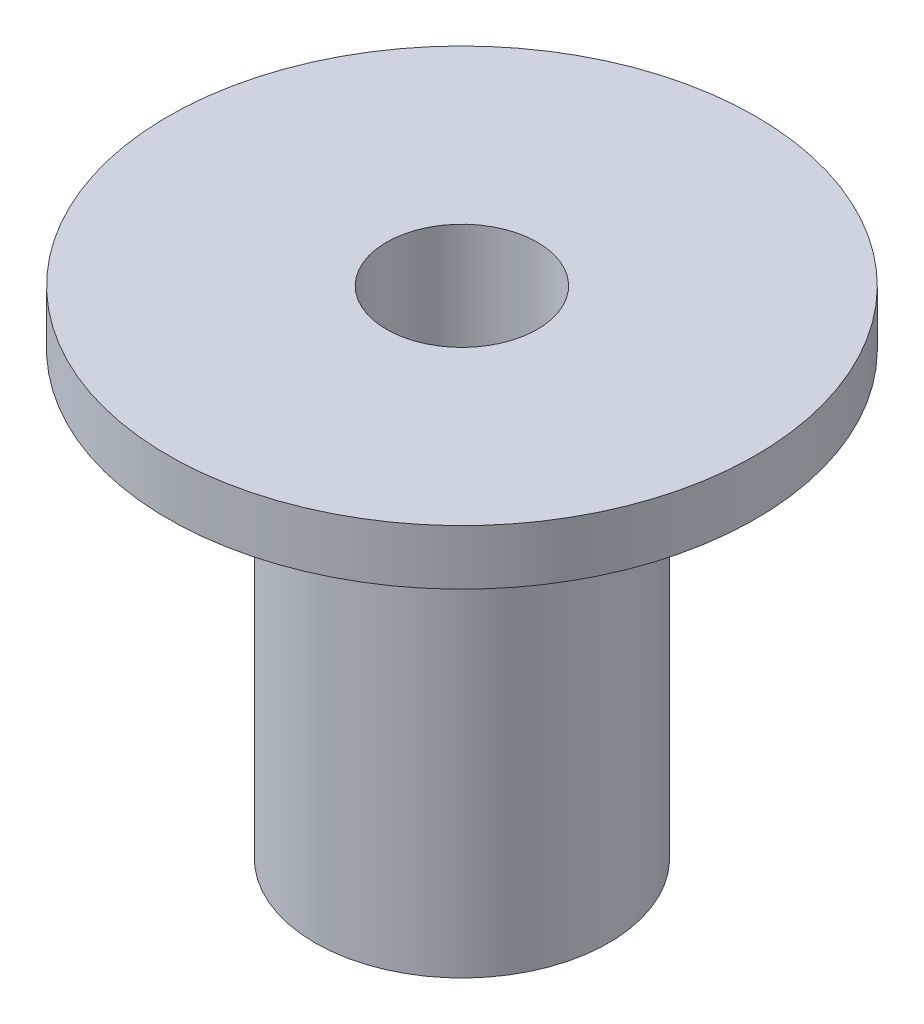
SolidWorks part; units mm, degrees
ref_plane "Front Plane" through (0, 0, 0) normal (0, 0, 1) x (1, 0, 0)
ref_plane "Top Plane" through (0, 0, 0) normal (0, 1, 0) x (1, 0, 0)
ref_plane "Right Plane" through (0, 0, 0) normal (1, 0, 0) x (0, 0, -1)
sketch "Sketch1" plane through (0, 0, 0) normal (0, 0, 1) x (1, 0, 0)
  line L0 (3.2639, 0) -> (3.2639, 21.4313)
  line L1 (3.2639, 21.4313) -> (12.7, 21.4313)
  line L2 (12.7, 21.4313) -> (12.7, 19.05)
  line L3 (12.7, 19.05) -> (6.35, 19.05)
  line L4 (6.35, 19.05) -> (6.35, 0)
  line L5 (6.35, 0) -> (3.2639, 0)
  line L6 (0, 0) -> (0, 21.4313) construction
  dimension "D1" = 19.05
  dimension "D2" = 6.35
  dimension "D3" = 3.2639
  dimension "D4" = 2.3813
  dimension "D5" = 12.7
revolve "Revolve1" add sketch "Sketch1" angle 360 about L6
